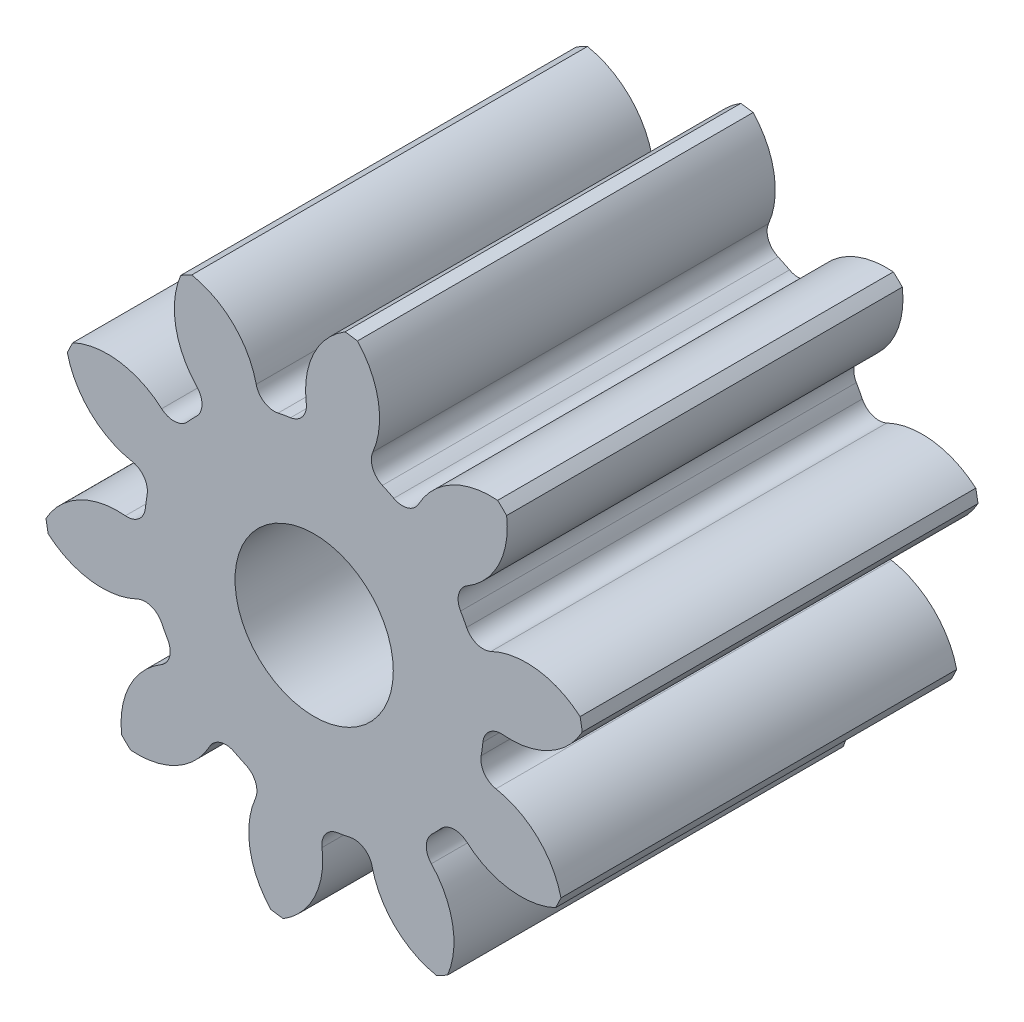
SolidWorks part; units mm, degrees
ref_plane "Front" through (0, 0, 0) normal (0, 0, 1) x (1, 0, 0)
ref_plane "Top" through (0, 0, 0) normal (0, 1, 0) x (1, 0, 0)
ref_plane "Right" through (0, 0, 0) normal (1, 0, 0) x (0, 0, -1)
sketch "Sketch3" plane through (0, 0, 0) normal (0, 0, 1) x (1, 0, 0)
  circle A0 centre (0, 0) radius 60.96
  dimension "od" = 121.92
extrude "gearBody" add sketch "Sketch3" along normal blind 88.9
sketch "Sketch2" plane through (0, 0, 0) normal (0, 0, 1) x (1, 0, 0)
  line L0 (0, 0) -> (44.1027, 18.2679) construction
  line L1 (55.7494, -26.9161) -> (0, 0) construction
  line L2 (0, 0) -> (36.3143, 0) construction
  line L3 (50.7885, 1.0796) -> (48.592, -14.8141) construction
  line L5 (49.6903, -6.8672) -> (0, 0) construction
  line L7 (0, 0) -> (47.7364, 0) construction
  arc A0 (47.736, 0.1865) -> (45.8961, -13.1266) centre (0, 0) ccw construction
  arc A1 (60.2403, 9.3396) -> (55.4492, -25.328) centre (0, 0) ccw construction
  arc A2 (50.7885, 1.0796) -> (48.592, -14.8141) centre (0, 0) ccw construction
  arc A3 (37.52, -6.6229) -> (37.9099, -3.8016) centre (0, 0) ccw
  arc A4 (55.7494, -26.9161) -> (40.8417, -11.4082) centre (37.4949, -29.5448) ccw
  arc A5 (55.7494, -26.9161) -> (60.96, 10.7867) centre (0, 0) ccw
  arc A6 (60.96, 10.7867) -> (42.405, -0.0966) centre (44.1027, 18.2679) cw
  arc A7 (37.9099, -3.8016) -> (42.405, -0.0966) centre (42.0244, -4.2142) cw
  arc A8 (40.8417, -11.4082) -> (37.52, -6.6229) centre (41.5921, -7.3417) cw
  point P6 (60.96, 10.7867)
  point P22 (55.7494, -26.9161)
  dimension "baseDia" = 95.4728
  dimension "od" = 121.92
  dimension "pd" = 101.6
  dimension "rd" = 76.2
  dimension "rFillet" = 4.1351
  dimension "pointX" = 60.96
  dimension "pointY" = 10.7867
  dimension "CTT" = 15.8937
  dimension "flankCenterAngle" = 22.5
extrude "toothCut" cut sketch "Sketch2" along normal through all
pattern_circular "CirPattern1" count 10 over 360 about axis through (0, 0, 0) along (0, 0, 1) of "toothCut"
sketch "hub1Dia" plane through (0, 0, 0) normal (0, 0, -1) x (-1, 0, 0)
  circle A0 centre (0, 0) radius 12.7
  dimension "hub1Dia" = 25.4
sketch "hub2Dia" plane through (0, 0, 88.9) normal (0, 0, 1) x (1, 0, 0)
  circle A0 centre (0, 0) radius 12.7
  dimension "hub2dia" = 25.4
sketch "boreDia" plane through (0, 0, 0) normal (0, 0, 1) x (1, 0, 0)
  circle A0 centre (0, 0) radius 17.78
  dimension "boreDia" = 35.56
extrude "bore" cut sketch "boreDia" against normal mid plane 25400
